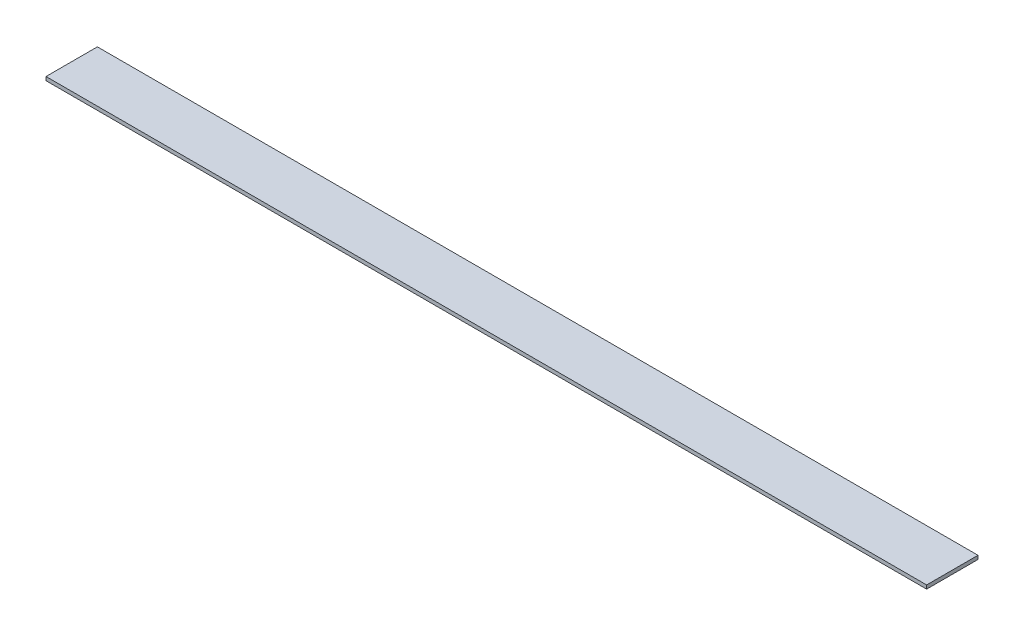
SolidWorks part; units mm, degrees
ref_plane "Front Plane" through (0, 0, 0) normal (0, 0, 1) x (1, 0, 0)
ref_plane "Top Plane" through (0, 0, 0) normal (0, 1, 0) x (1, 0, 0)
ref_plane "Right Plane" through (0, 0, 0) normal (1, 0, 0) x (0, 0, -1)
sketch "Sketch1" plane through (0, 0, 0) normal (0, 1, 0) x (1, 0, 0)
  line L1 (-1524, -88.9) -> (1524, -88.9)
  line L2 (-1524, -88.9) -> (-1524, 88.9)
  line L3 (-1524, 88.9) -> (1524, 88.9)
  line L4 (1524, -88.9) -> (1524, 88.9)
  line L5 (-1524, -88.9) -> (1524, 88.9) construction
  line L6 (-1524, 88.9) -> (1524, -88.9) construction
  point P0 (0, 0)
  dimension "D1" = 3048
  dimension "D2" = 177.8
extrude "Boss-Extrude1" add sketch "Sketch1" along normal blind 12.7
